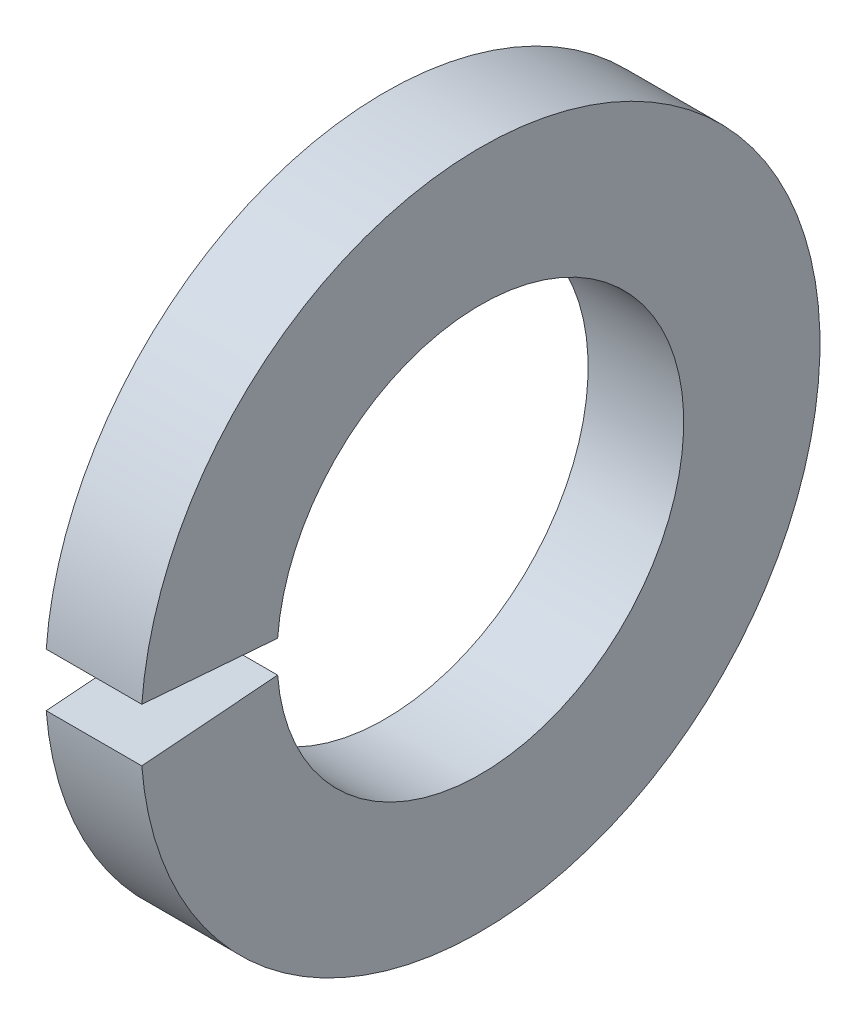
SolidWorks part; units mm, degrees
ref_plane "Plane1" through (0, 0, 0) normal (0, 0, 1) x (1, 0, 0)
ref_plane "Plane2" through (0, 0, 0) normal (0, 1, 0) x (1, 0, 0)
ref_plane "Plane3" through (0, 0, 0) normal (1, 0, 0) x (0, 0, -1)
sketch "Sketch1" plane through (0, 0, 0) normal (0, 0, 1) x (1, 0, 0)
  line L0 (-34.925, 0) -> (9.525, 0) construction
  line L1 (0, 2.54) -> (0, 4.2418)
  line L2 (0, 4.2418) -> (-1.1938, 4.2418)
  line L3 (-1.1938, 4.2418) -> (-1.1938, 2.54)
  line L4 (-1.1938, 2.54) -> (0, 2.54)
revolve "Base-Revolve" add sketch "Sketch1" angle 360 about L0
sketch "Sketch2" plane through (0, 0, 0) normal (-1, 0, 0) x (0, -1, 0)
  line L0 (0, 0) -> (0.3395, 4.3133)
  line L1 (0, -3.175) -> (0, 12.7) construction
  line L2 (0, 0) -> (-0.3395, 4.3133)
  arc A0 (0.3395, 4.3133) -> (-0.3395, 4.3133) centre (0, 0) ccw
extrude "Gap" cut sketch "Sketch2" along normal through all
equation "\"D1@Sketch2\" = \"Outside_dia@Sketch1\" * 0.51"
